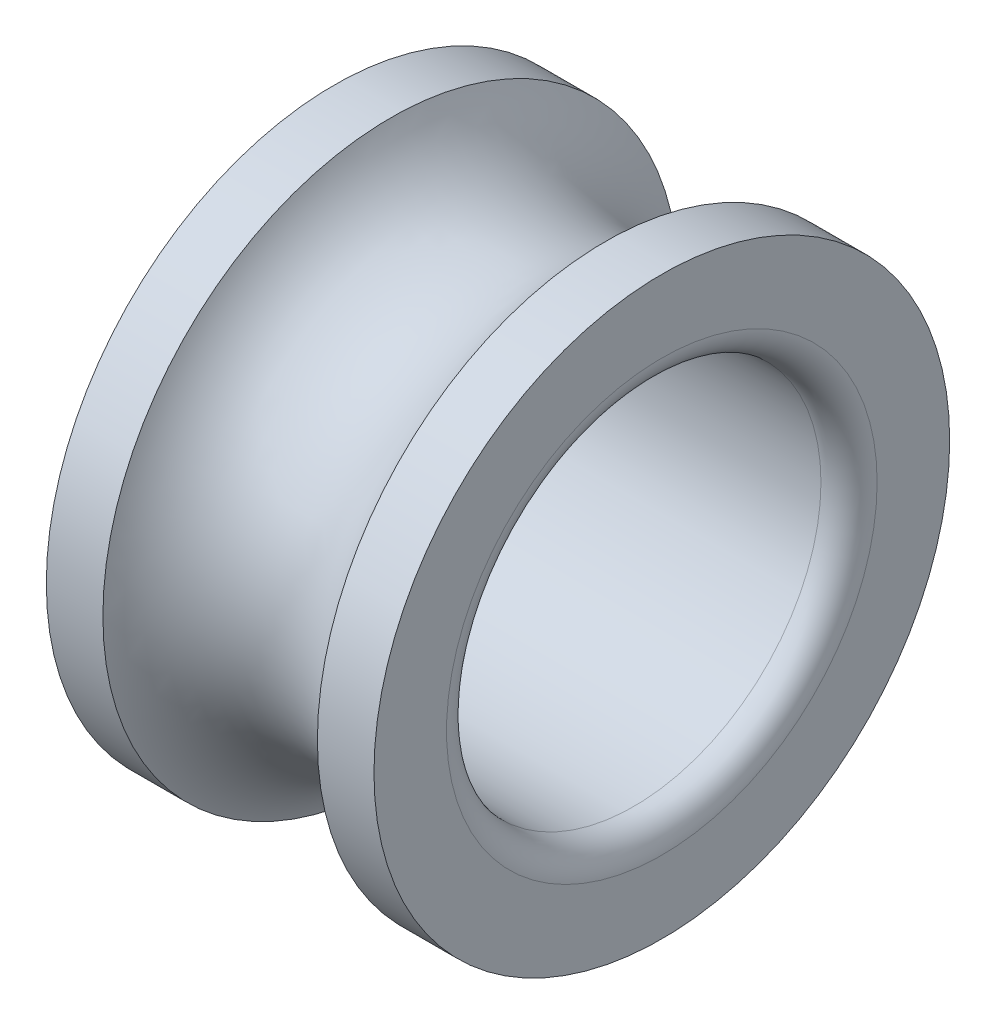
SolidWorks part; units mm, degrees
ref_plane "Front Plane" through (0, 0, 0) normal (0, 0, 1) x (1, 0, 0)
ref_plane "Top Plane" through (0, 0, 0) normal (0, 1, 0) x (1, 0, 0)
ref_plane "Right Plane" through (0, 0, 0) normal (1, 0, 0) x (0, 0, -1)
ref_plane "Plane4" through (0, 0, 0) normal (0, 0, 1) x (1, 0, 0)
sketch "Sketch1" plane through (0, 0, 0) normal (0, 0, 1) x (1, 0, 0)
  line L0 (0.6, 4) -> (6.4, 4)
  line L1 (7, 4.6) -> (7, 6.15)
  line L2 (7, 6.15) -> (5.7913, 6.15)
  line L3 (1.2087, 6.15) -> (0, 6.15)
  line L4 (0, 6.15) -> (0, 4.6)
  line L5 (9, 0) -> (0, 0) construction
  arc A0 (0, 4.6) -> (0.6, 4) centre (0.6, 4.6) ccw
  arc A1 (6.4, 4) -> (7, 4.6) centre (6.4, 4.6) ccw
  arc A2 (5.7913, 6.15) -> (1.2087, 6.15) centre (3.5, 7.15) cw
  dimension "D4" = 2.5
  dimension "D5" = 7.15
  dimension "D6" = 0.6
  dimension "D7" = 0.6
  dimension "D1" = 4
  dimension "D2" = 2.15
  dimension "D3" = 2.15
  dimension "D8" = 7
  dimension "D9" = 3.5
revolve "Revolve1" add sketch "Sketch1" angle 360 about L5
